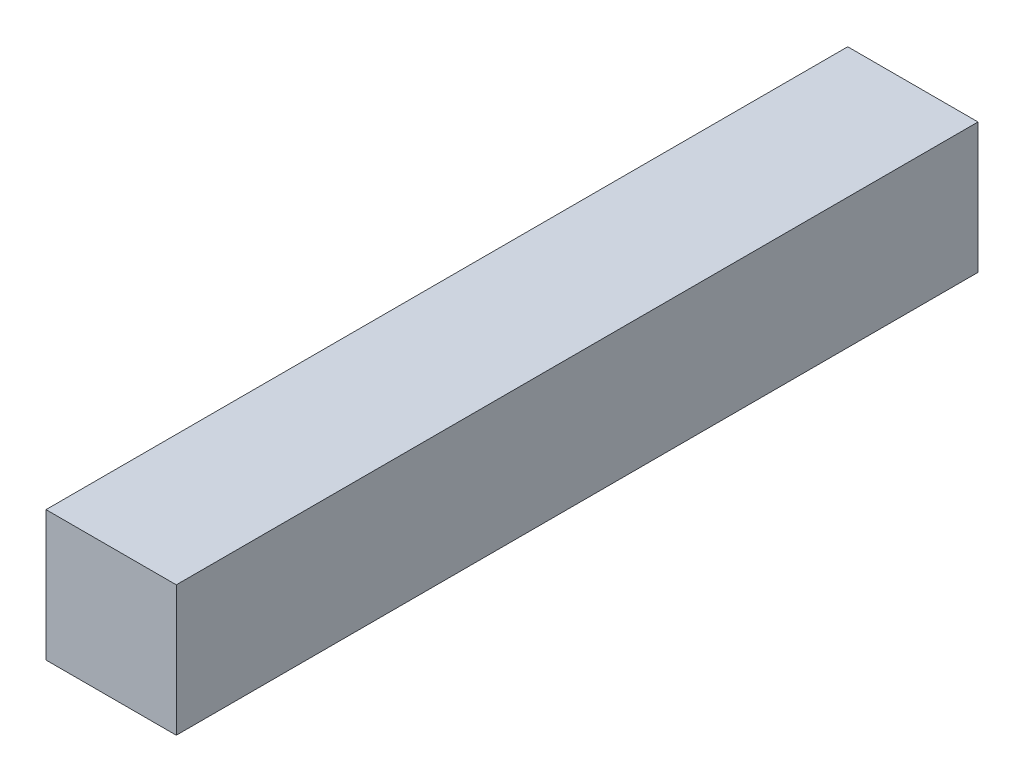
SolidWorks part; units mm, degrees
ref_plane "Plan de face" through (0, 0, 0) normal (0, 0, 1) x (1, 0, 0)
ref_plane "Plan de dessus" through (0, 0, 0) normal (0, 1, 0) x (1, 0, 0)
ref_plane "Plan de droite" through (0, 0, 0) normal (1, 0, 0) x (0, 0, -1)
sketch "Esquisse1" plane through (0, 0, 0) normal (0, 0, 1) x (1, 0, 0)
  line L1 (-6.5, 6.5) -> (6.5, 6.5)
  line L2 (-6.5, 6.5) -> (-6.5, -6.5)
  line L3 (-6.5, -6.5) -> (6.5, -6.5)
  line L4 (6.5, 6.5) -> (6.5, -6.5)
  point P4 (0, 6.5)
  point P5 (-6.5, 0)
  dimension "D1" = 13
extrude "Extrusion1" add sketch "Esquisse1" along normal mid plane 80
